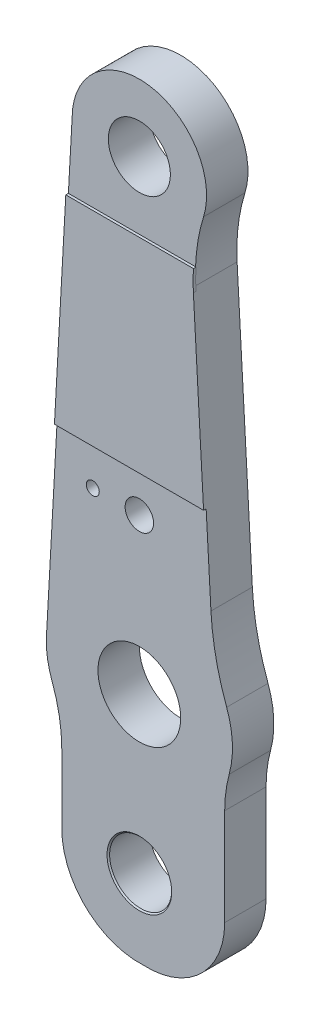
SolidWorks part; units mm, degrees
ref_plane "Plan1" through (0, 0, 0) normal (0, 0, 1) x (1, 0, 0)
ref_plane "Plan2" through (0, 0, 0) normal (0, 1, 0) x (1, 0, 0)
ref_plane "Plan3" through (0, 0, 0) normal (1, 0, 0) x (0, 0, -1)
sketch "Esquisse1" plane through (0, 0, 0) normal (0, 0, 1) x (1, 0, 0)
  line L0 (-110, 0) -> (110, 0) construction
  line L1 (0, 100) -> (0, -240) construction
  line L2 (21.7961, -32.3302) -> (27.6833, -138.3002)
  line L4 (-80, -240) -> (110, -240) construction
  line L5 (3, -190) -> (3, -250) construction
  line L6 (-50, -180) -> (50, -180) construction
  line L7 (-30, -240) -> (-30, -213.4066)
  line L8 (33, -240) -> (33, -202.5167)
  line L9 (-70, -120) -> (60, -120) construction
  line L12 (-26, 0) -> (-35.7785, -176.0123)
  arc A0 (24.8323, -7.7045) -> (-26, 0) centre (0, 0) ccw
  circle A1 centre (0, -120) radius 5.5
  circle A2 centre (0, 0) radius 12
  arc A4 (1.5, -269.9625) -> (33, -240) centre (3, -240) ccw
  circle A5 centre (0, -240) radius 12
  arc A6 (34.7442, -189.4256) -> (33.7578, -167.4935) centre (0, -180) ccw
  arc A7 (-33.75, -192.5275) -> (-30, -213.4066) centre (-90, -213.4066) cw
  arc A8 (33, -202.5167) -> (34.7442, -189.4256) centre (83, -202.5167) cw
  arc A10 (-35.7785, -176.0123) -> (-33.75, -192.5275) centre (0, -180) ccw
  arc A11 (27.6833, -138.3002) -> (33.7578, -167.4935) centre (127.5294, -132.7532) ccw
  arc A12 (21.7961, -32.3302) -> (24.8323, -7.7045) centre (91.6883, -28.4473) cw
  arc A14 (-30, -240) -> (1.5, -269.9625) centre (0, -240) ccw
  dimension "D1" = 52
  dimension "D2" = 120
  dimension "D3" = 24
  dimension "D6" = 11
  dimension "D7" = 60
  dimension "D8" = 60
  dimension "D9" = 24
  dimension "D10" = 72
  dimension "D11" = 60
  dimension "D12" = 50
  dimension "D14" = 100
  dimension "D15" = 70
  dimension "D4" = 240
  dimension "D5" = 3
extrude "Base-Extrusion" add sketch "Esquisse1" along normal blind 16
sketch "Esquisse2" plane through (0, 0, 16) normal (0, 0, 1) x (1, 0, 0)
  line L0 (-27.4444, -26) -> (21.9181, -26)
  line L1 (-60, 0) -> (90, 0) construction
  line L2 (-27.4444, -26) -> (-31.8333, -105)
  line L3 (21.8965, -34.1367) -> (25.8333, -105)
  line L4 (-26, 0) -> (-35.7785, -176.0123) construction
  line L5 (27.6833, -138.3002) -> (21.7961, -32.3302) construction
  line L6 (-60, -120) -> (70, -120) construction
  line L8 (-31.8333, -105) -> (25.8333, -105)
  arc A3 (21.8965, -34.1367) -> (21.9181, -26) centre (91.7887, -30.2538) cw
  dimension "D3" = 15
  dimension "D2" = 26
  dimension "D5" = 70
  dimension "D1" = 26
extrude "Boss.-Extru.1" add sketch "Esquisse2" along normal blind 1
chamfer "Chanfrein1" distance 0.5 angle 45 1 edges at (12, -240, 16)
sketch "Esquisse5" plane through (0, 0, 16) normal (0, 0, 1) x (1, 0, 0)
  line L0 (0, -180) -> (0, -260) construction
  line L1 (-20, -180) -> (18.3, -180) construction
  line L2 (0, 0) -> (0, -151.0944) construction
  circle A0 centre (0, -180) radius 16
  circle A2 centre (0, -240) radius 12 construction
  dimension "D1" = 60
extrude "Enlèv. mat.-Extru.3" cut sketch "Esquisse5" against normal through all
sketch "Esquisse4" plane through (0, 0, 16) normal (0, 0, 1) x (1, 0, 0)
  line L0 (-18, -110) -> (-18, -160) construction
  line L1 (0, -120) -> (-30, -120) construction
  circle A0 centre (-18, -120) radius 2.5
  dimension "D2" = 5
  dimension "D1" = 18
extrude "Enlèv. mat.-Extru.4" cut sketch "Esquisse4" against normal through all
sketch "Esquisse6" plane through (0, 0, 0) normal (0, 0, -1) x (-1, 0, 0)
  line L0 (0, -360.4011) -> (0, 78.9788) construction
